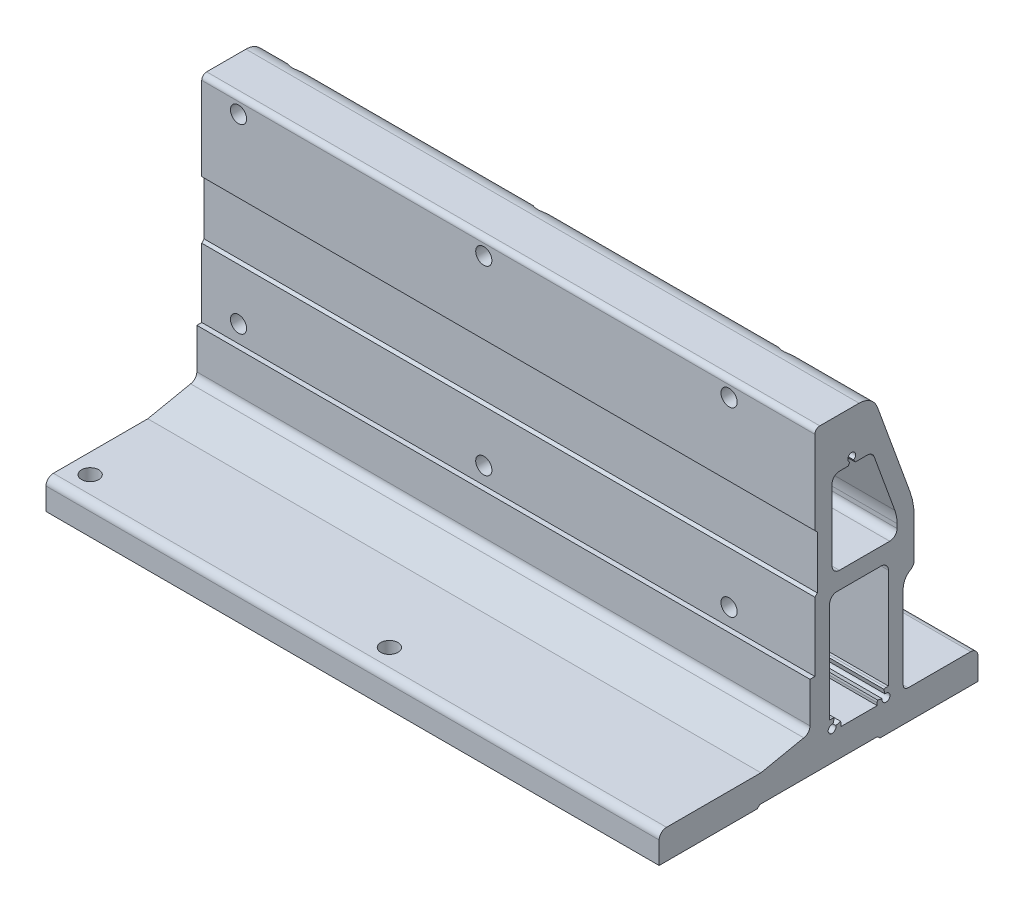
SolidWorks part; units mm, degrees
ref_plane "정면" through (0, 0, 0) normal (0, 0, 1) x (1, 0, 0)
ref_plane "윗면" through (0, 0, 0) normal (0, 1, 0) x (1, 0, 0)
ref_plane "우측면" through (0, 0, 0) normal (1, 0, 0) x (0, 0, -1)
sketch "스케치1" plane through (0, 0, 0) normal (1, 0, 0) x (0, 0, -1)
  line L0 (-1.5, 85.5) -> (-1.5, 119.5)
  line L1 (0.5, 121.5) -> (16.5142, 121.5)
  line L2 (24.0317, 116.2362) -> (37.1908, 80.0819)
  line L3 (39, 69.8213) -> (39, 54.7942)
  line L4 (34.5, 47) -> (34.5, 13)
  line L5 (36.5, 11) -> (62, 11)
  line L6 (65, 8) -> (65, -1)
  line L7 (65, -1) -> (25, -1)
  line L8 (25, -1) -> (24, 0)
  line L9 (24, 0) -> (-24, 0)
  line L10 (-24, 0) -> (-25, -1)
  line L11 (-25, -1) -> (-65, -1)
  line L12 (-65, -1) -> (-65, 8)
  line L13 (-62, 11) -> (-23.5, 11)
  line L14 (-23.5, 11) -> (-6.0351, 14.6023)
  line L15 (-3.5, 17.5661) -> (-3.5, 34)
  line L16 (-3.5, 34) -> (-1.5, 34)
  line L17 (-1.5, 34) -> (-1.5, 62)
  line L18 (-1.5, 62) -> (-0.5, 63)
  line L19 (-0.5, 63) -> (-0.5, 84.5)
  line L20 (-0.5, 84.5) -> (-1.5, 85.5)
  line L21 (22.6644, 99.5261) -> (31.0954, 76.3622)
  line L22 (32, 71.2319) -> (32, 69.5)
  line L23 (29, 66.5) -> (8.5, 66.5)
  line L24 (5.5, 69.5) -> (5.5, 98.5)
  line L25 (8.5, 101.5) -> (12.0566, 101.5)
  line L26 (12.0566, 101.5) -> (12.7, 102.6144)
  line L27 (14.3, 102.6144) -> (14.9434, 101.5)
  line L28 (14.9434, 101.5) -> (19.8454, 101.5)
  line L29 (28.5, 15.6) -> (28.5, 56.5)
  line L30 (25.5, 59.5) -> (7.5, 59.5)
  line L31 (4.5, 56.5) -> (4.5, 15.6)
  line L32 (4.5, 15.6) -> (5.5, 15.6)
  line L33 (6.4317, 15.4773) -> (5.9141, 13.5455)
  line L34 (7.0455, 12.4141) -> (8.9773, 12.9317)
  line L35 (9.1, 12) -> (9.1, 11)
  line L36 (9.1, 11) -> (23.9, 11)
  line L37 (23.9, 11) -> (23.9, 12)
  line L38 (24.0227, 12.9317) -> (25.9545, 12.4141)
  line L39 (27.0859, 13.5455) -> (26.5683, 15.4773)
  line L40 (27.5, 15.6) -> (28.5, 15.6)
  arc A0 (0.5, 121.5) -> (-1.5, 119.5) centre (0.5, 119.5) ccw
  arc A1 (24.0317, 116.2362) -> (16.5142, 121.5) centre (16.5142, 113.5) ccw
  arc A2 (39, 69.8213) -> (37.1908, 80.0819) centre (9, 69.8213) ccw
  arc A3 (37.5, 52.1962) -> (39, 54.7942) centre (36, 54.7942) ccw
  arc A4 (37.5, 52.1962) -> (34.5, 47) centre (40.5, 47) ccw
  arc A5 (34.5, 13) -> (36.5, 11) centre (36.5, 13) ccw
  arc A6 (65, 8) -> (62, 11) centre (62, 8) ccw
  arc A7 (-62, 11) -> (-65, 8) centre (-62, 8) ccw
  arc A8 (-6.0351, 14.6023) -> (-3.5, 17.5661) centre (-6.5, 17.5661) ccw
  arc A9 (32, 71.2319) -> (31.0954, 76.3622) centre (17, 71.2319) ccw
  arc A10 (29, 66.5) -> (32, 69.5) centre (29, 69.5) ccw
  arc A11 (5.5, 69.5) -> (8.5, 66.5) centre (8.5, 69.5) ccw
  arc A12 (8.5, 101.5) -> (5.5, 98.5) centre (8.5, 98.5) ccw
  arc A13 (14.3, 102.6144) -> (12.7, 102.6144) centre (13.5, 104) ccw
  arc A14 (22.6644, 99.5261) -> (19.8454, 101.5) centre (19.8454, 98.5) ccw
  arc A15 (28.5, 56.5) -> (25.5, 59.5) centre (25.5, 56.5) ccw
  arc A16 (7.5, 59.5) -> (4.5, 56.5) centre (7.5, 56.5) ccw
  arc A17 (6.4317, 15.4773) -> (5.5, 15.6) centre (5.5, 12) ccw
  arc A18 (5.9141, 13.5455) -> (7.0455, 12.4141) centre (5.5, 12) ccw
  arc A19 (9.1, 12) -> (8.9773, 12.9317) centre (5.5, 12) ccw
  arc A20 (24.0227, 12.9317) -> (23.9, 12) centre (27.5, 12) ccw
  arc A21 (25.9545, 12.4141) -> (27.0859, 13.5455) centre (27.5, 12) ccw
  arc A22 (27.5, 15.6) -> (26.5683, 15.4773) centre (27.5, 12) ccw
extrude "보스-돌출1" add sketch "스케치1" along normal mid plane 250
hole_wizard "M6 소켓 머리 캡 나사용 카운터보어1" positions "스케치2" profile "스케치3" counterbore size "M6" standard "KS"
sketch "스케치2" plane through (0, 0, -39) normal (0, 0, -1) x (-1, 0, 0)
  line L0 (-125, 80.0819) -> (-125, 116.2362) construction
  line L1 (-125, -1) -> (125, -1) construction
  point P0 (-90, 115)
  point P6 (-90, 41)
  dimension "D1" = 35
  dimension "D4" = 42
  dimension "D5" = 74
sketch "스케치3" plane through (90, 115, -39) normal (1, 0, 0) x (0, 1, 0)
  line L0 (0, 0) -> (0, 104)
  line L1 (0, 104) -> (3.3, 104)
  line L3 (3.3, 104) -> (3.3, 34.5)
  line L4 (3.3, 34.5) -> (5.5, 34.5)
  line L5 (5.5, 34.5) -> (5.5, 0)
  line L7 (5.5, 0) -> (0, 0)
  line L11 (0, -6.35) -> (0, 107.95) construction
  dimension "관통 구멍 지름" = 6.6
  dimension "관통 구멍 깊이" = 104
  dimension "카운터보어 지름" = 11
  dimension "카운터보어 깊이" = 34.5
pattern_linear "선형 패턴1" count 3 spacing 100 along (-1, 0, 0) of "M6 소켓 머리 캡 나사용 카운터보어1"
hole_wizard "M4 나사 구멍1" positions "스케치4" profile "스케치5" tap size "M4" standard "ISO"
sketch "스케치4" plane through (-125, 0, 0) normal (-1, 0, 0) x (0, 0, 1)
  line L0 (-65, -1) -> (-65, 8) construction
  line L1 (-25, -1) -> (-65, -1) construction
  point P0 (-37, 5)
  point P2 (-9, 5)
  dimension "D1" = 28
  dimension "D2" = 28
  dimension "D3" = 6
sketch "스케치5" plane through (-125, 5, -37) normal (0, 1, 0) x (0, 0, 1)
  line L0 (0, 0) -> (0, 10.9914)
  line L1 (0, 10.9914) -> (1.65, 10)
  line L2 (1.65, 10) -> (1.65, 0)
  line L5 (1.65, 0) -> (0, 0)
  line L10 (0, 10.9914) -> (-1.65, 10) construction
  line L11 (0, -6.35) -> (0, 107.95) construction
  dimension "탭 드릴 지름" = 3.3
  dimension "탭 드릴 깊이" = 10
  dimension "드릴 각도" = 118
hole_wizard "Ø5.0mm 맞춤핀 구멍1" positions "스케치6" profile "스케치7" hole size "Ø5.0" standard "ISO"
sketch "스케치6" plane through (0, 0, 0) normal (0, -1, 0) x (-1, 0, 0)
  line L0 (0, 0) -> (139.5417, 0) construction
  line L1 (125, -24) -> (125, 24) construction
  point P6 (117, 0)
  point P8 (-5, 0)
  dimension "D1" = 8
  dimension "D2" = 122
sketch "스케치7" plane through (5, 0, 0) normal (1, 0, 0) x (0, 0, -1)
  line L0 (0, 0) -> (0, 11.5022)
  line L1 (0, 11.5022) -> (2.5, 10)
  line L2 (2.5, 10) -> (2.5, 0)
  line L5 (2.5, 0) -> (0, 0)
  line L10 (0, 11.5022) -> (-2.5, 10) construction
  line L11 (0, -6.35) -> (0, 107.95) construction
  dimension "구멍 지름" = 5
  dimension "구멍 깊이" = 10
  dimension "드릴 각도" = 118
hole_wizard "Ø7.0 (7) 지름 구멍1" positions "스케치8" profile "스케치9" hole size "Ø7.0" standard "ISO"
sketch "스케치8" plane through (0, -1, 0) normal (0, -1, 0) x (-1, 0, 0)
  line L0 (125, -65) -> (125, -25) construction
  line L1 (-125, 65) -> (125, 65) construction
  point P0 (117, -55)
  point P2 (-5, -55)
  point P4 (117, 55)
  point P6 (-5, 55)
  dimension "D1" = 8
  dimension "D2" = 122
  dimension "D3" = 10
  dimension "D4" = 110
sketch "스케치9" plane through (-117, -1, 55) normal (1, 0, 0) x (0, 0, -1)
  line L0 (0, 0) -> (0, 122.5)
  line L1 (0, 122.5) -> (3.5, 122.5)
  line L2 (3.5, 122.5) -> (3.5, 0)
  line L5 (3.5, 0) -> (0, 0)
  line L11 (0, -6.35) -> (0, 107.95) construction
  dimension "관통 구멍 지름" = 7
  dimension "관통 구멍 깊이" = 122.5
